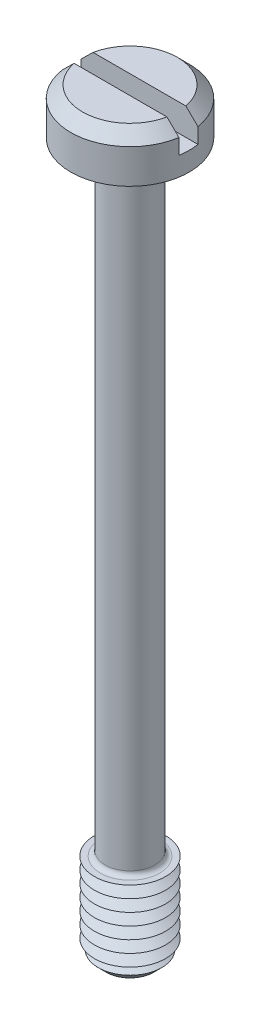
SolidWorks part; units mm, degrees
ref_plane "Front Plane" through (0, 0, 0) normal (0, 0, 1) x (1, 0, 0)
ref_plane "Top Plane" through (0, 0, 0) normal (0, 1, 0) x (1, 0, 0)
ref_plane "Right Plane" through (0, 0, 0) normal (1, 0, 0) x (0, 0, -1)
sketch "Sketch1" plane through (0, 0, 0) normal (0, 1, 0) x (1, 0, 0)
  circle A0 centre (0, 0) radius 5
  dimension "D1" = 10
extrude "Boss-Extrude1" add sketch "Sketch1" along normal blind 3.9
sketch "Sketch2" plane through (0, 0, 0) normal (0, -1, 0) x (1, 0, 0)
  circle A0 centre (0, 0) radius 2.1
  dimension "D1" = 4.2
extrude "Boss-Extrude2" add sketch "Sketch2" along normal blind 60
sketch "Sketch3" plane through (0, -60, 0) normal (0, -1, 0) x (1, 0, 0)
  circle A0 centre (0, 0) radius 3
  dimension "D1" = 6
extrude "Boss-Extrude3" add sketch "Sketch3" against normal blind 7.5
chamfer "Chamfer1" distance 1 angle 45 1 edges at (0, -60, -3)
sketch "Sketch4" plane through (0, 0, 0) normal (1, 0, 0) x (0, 0, -1)
  line L0 (0, -6.5871) -> (0, -12.0372) construction
sketch "Sketch5" plane through (0, 0, 0) normal (1, 0, 0) x (0, 0, -1)
  line L0 (-3, -52.5) -> (-2.134, -53)
  line L1 (-2.134, -53) -> (-3, -53.5)
  line L2 (-3, -52.5) -> (-3, -59) construction
  line L3 (-3, -53.5) -> (-3, -52.5)
  dimension "D1" = 1
revolve "Cut-Revolve1" cut sketch "Sketch5" angle 360 about L0
pattern_linear "LPattern1" count 7 spacing 1 along (0, -1, 0) of "Cut-Revolve1"
fillet "Fillet1" radius 0.4 2 edges at (0, -52.5, -2.1) (0, 0, -2.1)
chamfer "Chamfer2" distance 1 angle 45 1 edges at (0, 3.9, 5)
sketch "Sketch6" plane through (0, 3.9, 0) normal (0, 1, 0) x (1, 0, 0)
  line L1 (5, -0.8) -> (-5, -0.8)
  line L2 (5, -0.8) -> (5, 0.8)
  line L3 (5, 0.8) -> (-5, 0.8)
  line L4 (-5, -0.8) -> (-5, 0.8)
  line L5 (5, -0.8) -> (-5, 0.8) construction
  line L6 (5, 0.8) -> (-5, -0.8) construction
  circle A0 centre (0, 0) radius 5 construction
  point P0 (0, 0)
  dimension "D1" = 1.6
extrude "Cut-Extrude1" cut sketch "Sketch6" against normal blind 2.3
